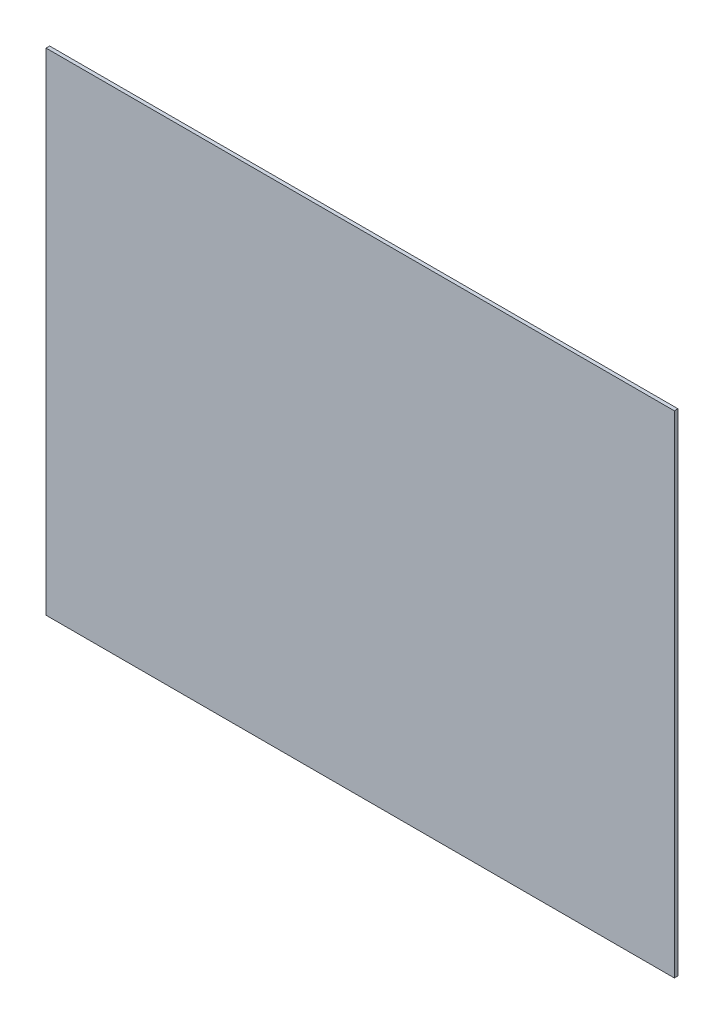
SolidWorks part; units mm, degrees
ref_plane "Front Plane" through (0, 0, 0) normal (0, 0, 1) x (1, 0, 0)
ref_plane "Top Plane" through (0, 0, 0) normal (0, 1, 0) x (1, 0, 0)
ref_plane "Right Plane" through (0, 0, 0) normal (1, 0, 0) x (0, 0, -1)
sketch "Sketch1" plane through (0, 0, 0) normal (0, 0, 1) x (1, 0, 0)
  line L0 (-34.625, 52.525) -> (314.625, -220.525) construction
  line L1 (-34.625, 52.525) -> (314.625, 52.525)
  line L2 (-34.625, 52.525) -> (-34.625, -220.525)
  line L3 (-34.625, -220.525) -> (314.625, -220.525)
  line L4 (314.625, 52.525) -> (314.625, -220.525)
  line L5 (280, 0) -> (0, -168) construction
  line L6 (0, 0) -> (280, -168) construction
  point P8 (140, -84)
  point P9 (140, -84)
  point P14 (140, -84)
  dimension "D1" = 349.25
  dimension "D2" = 273.05
extrude "Boss-Extrude1" add sketch "Sketch1" along normal blind 2
